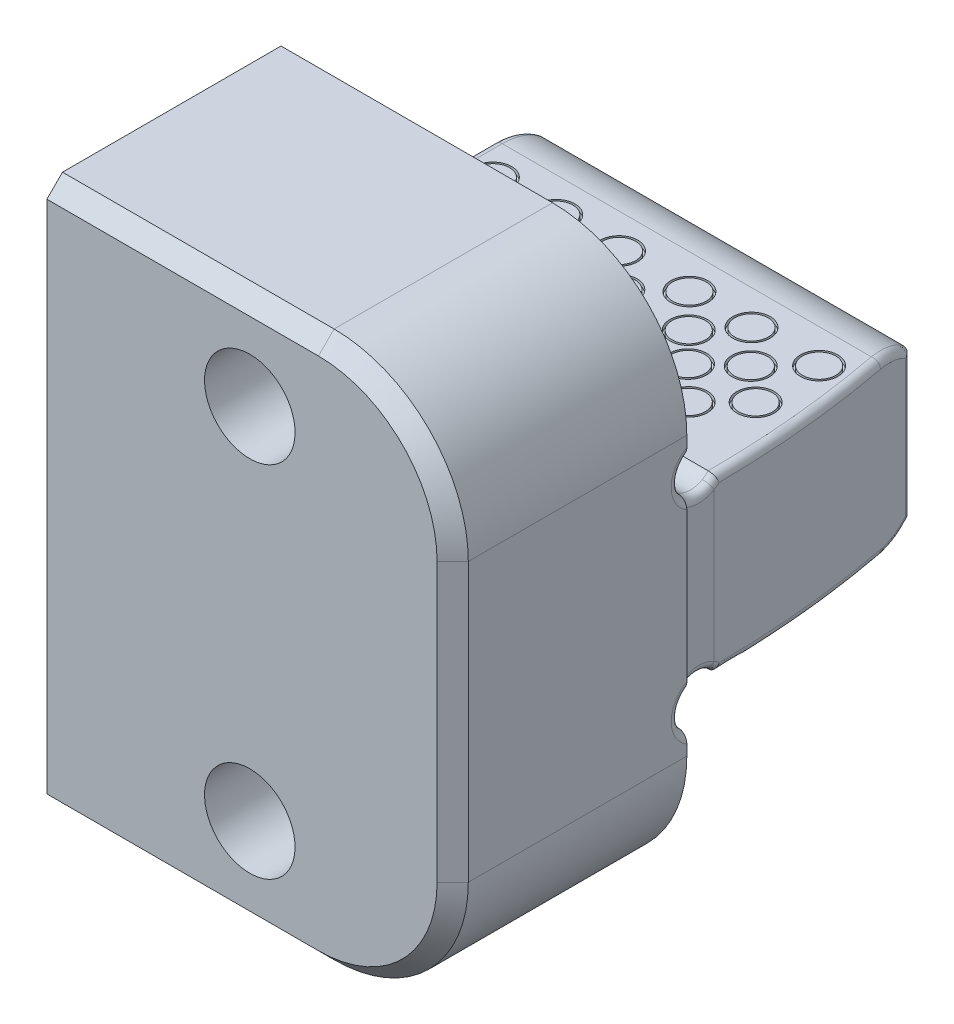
SolidWorks part; units mm, degrees
ref_plane "Front Plane" through (0, 0, 0) normal (0, 0, 1) x (1, 0, 0)
ref_plane "Top Plane" through (0, 0, 0) normal (0, 1, 0) x (1, 0, 0)
ref_plane "Right Plane" through (0, 0, 0) normal (1, 0, 0) x (0, 0, -1)
sketch "Sketch3" plane through (0, 0, 0) normal (1, 0, 0) x (0, 0, -1)
  line L0 (0, 8.7312) -> (0, -8.7312) construction
  line L1 (-15, -17.5) -> (0, -17.5)
  line L2 (-15, -17.5) -> (-15, 17.5)
  line L3 (-15, 17.5) -> (0, 17.5)
  line L4 (16.17, -5.4975) -> (16.17, 5.4975)
  line L6 (0, -17.5) -> (0, -5.4975)
  line L7 (0, -5.4975) -> (16.17, -5.4975)
  line L8 (0, 17.5) -> (0, 5.4975)
  line L9 (0, 5.4975) -> (16.17, 5.4975)
  line L10 (0, 0) -> (50000, 0) construction
  dimension "D1" = 31.17
  dimension "D2" = 15
  dimension "D3" = 35
  dimension "D4" = 10.995
extrude "Extrude1" add sketch "Sketch3" along normal mid plane 26
sketch "Sketch7" plane through (13, 0, 0) normal (1, 0, 0) x (0, 0, -1)
  line L0 (0, 17.5) -> (-15, 17.5) construction
  line L1 (0, -17.5) -> (21.9683, -17.5)
  line L2 (0, -17.5) -> (0, 17.5)
  line L3 (0, 17.5) -> (21.9683, 17.5)
  line L4 (21.9683, -17.5) -> (21.9683, 17.5)
  line L5 (0, -17.5) -> (0, -5.4975) construction
  line L6 (-15, -17.5) -> (0, -17.5) construction
extrude "Cut-Extrude3" cut sketch "Sketch7" against normal blind 0.25
sketch "Sketch8" plane through (13, 0, 0) normal (1, 0, 0) x (0, 0, -1)
  line L0 (0, 0) -> (50000, 0) construction
  line L1 (0, -17.5) -> (0, 17.5) construction
  line L2 (0, 5.4975) -> (16.17, 5.4975) construction
  circle A0 centre (1, 6.4975) radius 1.5
  circle A1 centre (1, -6.4975) radius 1.5
  dimension "D1" = 1.5
  dimension "D2" = 0.5
  dimension "D3" = 0.5
extrude "Cut-Extrude4" cut sketch "Sketch8" against normal through all
sketch "Sketch9" plane through (13, 0, 0) normal (1, 0, 0) x (0, 0, -1)
  line L0 (2.118, 5.4975) -> (16.17, 5.4975) construction
  line L1 (16.17, 5.4975) -> (16.17, -5.4975) construction
  line L2 (0, 0) -> (50000, 0) construction
  line L3 (16.17, 4.6385) -> (20.17, 4.6385)
  line L4 (13.67, 5.4975) -> (13.67, 11.1385)
  line L5 (13.67, 11.1385) -> (20.17, 11.1385)
  line L6 (20.17, 4.6385) -> (20.17, 11.1385)
  line L7 (20.17, -4.6385) -> (20.17, -11.1385)
  line L8 (13.67, -11.1385) -> (20.17, -11.1385)
  line L9 (13.67, -5.4975) -> (13.67, -11.1385)
  line L10 (16.17, -4.6385) -> (20.17, -4.6385)
  arc A0 (13.67, 5.4975) -> (15.8439, 5.1072) centre (13.67, -0.7525) cw construction
  arc A1 (15.8439, 5.1072) -> (16.17, 4.6385) centre (15.67, 4.6385) cw construction
  arc A2 (15.8439, -5.1072) -> (16.17, -4.6385) centre (15.67, -4.6385) ccw construction
  arc A3 (13.67, -5.4975) -> (15.8439, -5.1072) centre (13.67, 0.7525) ccw construction
  arc A4 (13.67, 5.4975) -> (16.17, 4.6385) centre (13.67, 1.4302) cw
  arc A5 (13.67, -5.4975) -> (16.17, -4.6385) centre (13.67, -1.4302) ccw
  dimension "D1" = 0.5
  dimension "D2" = 6.25
  dimension "D3" = 2.5
  dimension "D4" = 6.5
  dimension "D5" = 6.5
extrude "Cut-Extrude5" cut sketch "Sketch9" against normal through all
sketch "Sketch13" plane through (0, 17.5, 0) normal (0, 1, 0) x (1, 0, 0)
  line L0 (12.75, 2.118) -> (12.75, 13.67) construction
  line L2 (7.5773, 27) -> (27.5773, 27)
  line L4 (12.75, 2) -> (27.5773, 2)
  line L5 (27.5773, 27) -> (27.5773, 2)
  arc A0 (7.5773, 27) -> (12.75, 2) centre (-50.25, 2) cw
  dimension "D1" = 63
  dimension "D2" = 2
  dimension "D3" = 25
  dimension "D4" = 20
extrude "Cut-Extrude6" cut sketch "Sketch13" against normal through all
sketch "Sketch15" plane through (0, 5.4975, 0) normal (0, 1, 0) x (1, 0, 0)
  circle A0 centre (9.9718, 11.5035) radius 1.2
  circle A1 centre (9.9718, 11.5035) radius 1.07
  circle A2 centre (-6.8259, 11.4592) radius 1.2
  circle A3 centre (-6.8259, 11.4592) radius 1.07
  circle A4 centre (-10.9299, 11.5035) radius 1.2
  circle A5 centre (-10.9299, 11.5035) radius 1.07
  circle A6 centre (5.6839, 11.4592) radius 1.2
  circle A7 centre (5.6839, 11.4592) radius 1.07
  circle A8 centre (1.7056, 11.4592) radius 1.2
  circle A9 centre (1.7056, 11.4592) radius 1.07
  circle A10 centre (-2.8033, 11.4592) radius 1.2
  circle A11 centre (-2.8033, 11.4592) radius 1.07
  circle A14 centre (-4.7041, 9.2932) radius 1.2
  circle A15 centre (-4.7041, 9.2932) radius 1.07
  circle A16 centre (-8.7639, 9.2932) radius 1.2
  circle A17 centre (-8.7639, 9.2932) radius 1.07
  circle A18 centre (7.8057, 9.2932) radius 1.2
  circle A19 centre (7.8057, 9.2932) radius 1.07
  circle A20 centre (3.8274, 9.2932) radius 1.2
  circle A21 centre (3.8274, 9.2932) radius 1.07
  circle A22 centre (-0.6815, 9.2932) radius 1.2
  circle A23 centre (-0.6815, 9.2932) radius 1.07
  circle A24 centre (9.9718, 7.4367) radius 1.2
  circle A25 centre (9.9718, 7.4367) radius 1.07
  circle A26 centre (-6.8259, 7.3925) radius 1.2
  circle A27 centre (-6.8259, 7.3925) radius 1.07
  circle A28 centre (-10.9299, 7.4367) radius 1.2
  circle A29 centre (-10.9299, 7.4367) radius 1.07
  circle A30 centre (5.6839, 7.3925) radius 1.2
  circle A31 centre (5.6839, 7.3925) radius 1.07
  circle A32 centre (1.7056, 7.3925) radius 1.2
  circle A33 centre (1.7056, 7.3925) radius 1.07
  circle A34 centre (-2.8033, 7.3925) radius 1.2
  circle A35 centre (-2.8033, 7.3925) radius 1.07
  circle A38 centre (-4.7041, 5.3149) radius 1.2
  circle A39 centre (-4.7041, 5.3149) radius 1.07
  circle A40 centre (-8.7639, 5.3149) radius 1.2
  circle A41 centre (-8.7639, 5.3149) radius 1.07
  circle A42 centre (7.8057, 5.3149) radius 1.2
  circle A43 centre (7.8057, 5.3149) radius 1.07
  circle A44 centre (3.8274, 5.3149) radius 1.2
  circle A45 centre (3.8274, 5.3149) radius 1.07
  circle A46 centre (-0.6815, 5.3149) radius 1.2
  circle A47 centre (-0.6815, 5.3149) radius 1.07
  dimension "D7" = 2.4
  dimension "D8" = 2.14
extrude "Cut-Extrude7" cut sketch "Sketch15" against normal blind 0.254
mirror "Mirror1" about plane through (0, 0, 0) normal (0, 1, 0) of "Cut-Extrude7"
hole_wizard "CBORE for M5 SHCS1" positions "Sketch17" profile "Sketch16" counterbore size "M5" standard "Ansi Metric"
sketch "Sketch17" plane through (0, 0, 0) normal (0, 0, -1) x (-1, 0, 0)
  line L0 (0, 0) -> (50000, 0) construction
  point P0 (0, 11.5)
  point P9 (0, -11.5)
  dimension "D1" = 23
sketch "Sketch16" plane through (0, 11.5, 0) normal (1, 0, 0) x (0, 1, 0)
  line L0 (0, 0) -> (0, 15)
  line L1 (0, 15) -> (2.9, 15)
  line L3 (2.9, 15) -> (2.9, 6.5)
  line L4 (2.9, 6.5) -> (5, 6.5)
  line L5 (5, 6.5) -> (5, 0)
  line L7 (5, 0) -> (0, 0)
  line L11 (0, -6.35) -> (0, 107.95) construction
  dimension "Thru Hole Dia." = 5.8
  dimension "Thru Hole Depth" = 15
  dimension "C'Bore Dia." = 10
  dimension "C'Bore Depth" = 6.5
fillet "Fillet1" radius 8.6 2 edges at (13, -17.5, 7.5) (13, 17.5, 7.5)
chamfer "Chamfer1" distance 1 angle 45 5 edges at (-4.3, 17.5, 15) (-4.3, -17.5, 15) (13, 0, 15) (10.4811, 14.9811, 15) (10.4811, -14.9811, 15)
chamfer "Chamfer2" distance 0.4 angle 45 4 edges at (-0.0263, -6.5001, 0.5) (0, -16.5, 0) (0.0263, 6.5001, 0.5) (0, 16.5, 0)
fillet "Fillet2" radius 0.5 18 edges at (11.406, -5.293, -14.9436) (12.75, 4.9975, -1) (12.4713, 5.4975, -7.9192) (11.3856, 5.2597, -15.0403) (11.1358, 0, -16.17) (12.4713, -5.4975, -7.9192) (13, 6.4975, 0.5) (12.875, 5.3795, 0) (12.75, -4.9975, -1) (-13, -5.4975, -7.894) (13, -6.4975, 0.5) (12.875, -5.3795, 0) (-13, 5.4975, -7.894) (-13, 5.2768, -14.9917) (-13, 0, -16.17) (-13, -5.2768, -14.9917)
